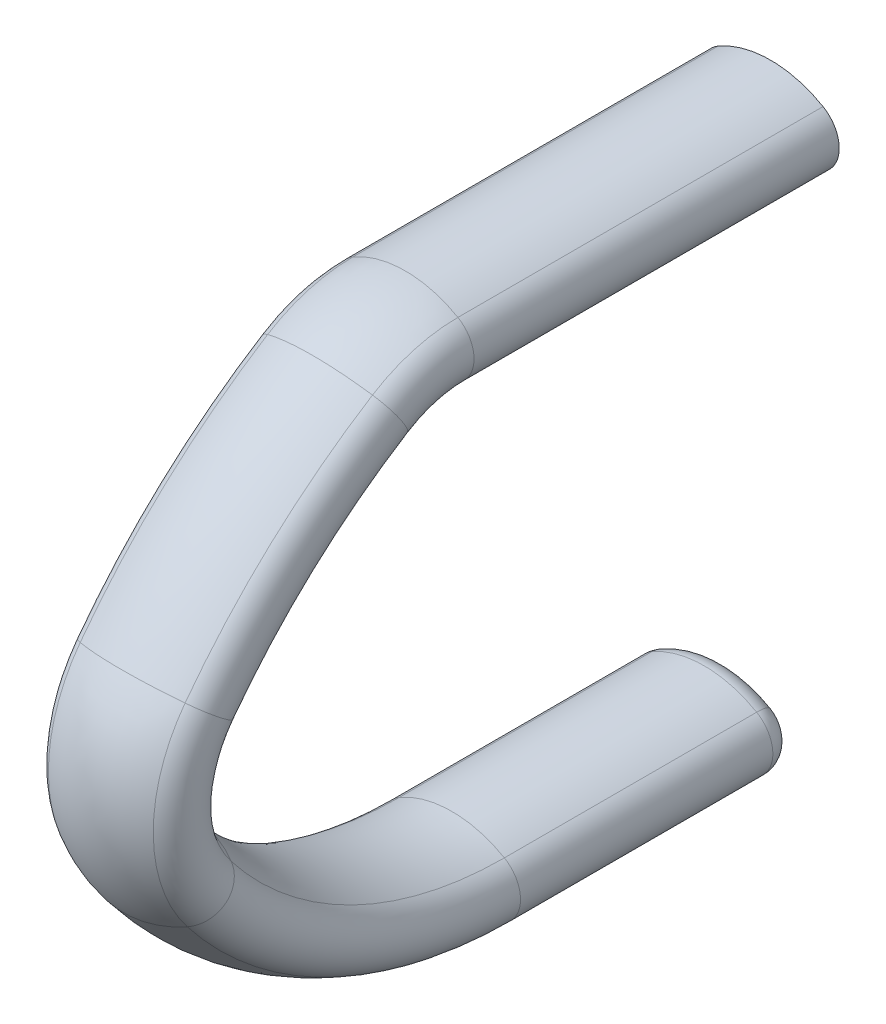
SolidWorks part; units mm, degrees
ref_plane "Plan de face" through (0, 0, 0) normal (0, 0, 1) x (1, 0, 0)
ref_plane "Plan de dessus" through (0, 0, 0) normal (0, 1, 0) x (1, 0, 0)
ref_plane "Plan de droite" through (0, 0, 0) normal (1, 0, 0) x (0, 0, -1)
sketch "Esquisse1" plane through (0, 0, 0) normal (1, 0, 0) x (0, 0, -1)
  line L0 (-20, -222) -> (-144, -222)
  line L1 (-165, 0) -> (0, 0)
  line L2 (0, 55) -> (0, -55) construction
  arc A0 (-277.3188, -156.8908) -> (-144, -222) centre (-144, -52.9524) ccw
  arc A1 (-278.1248, -84.1669) -> (-277.3188, -156.8908) centre (-230, -120) ccw
  arc A2 (-196.8748, -9.1669) -> (-278.1248, -84.1669) centre (-37.501, -263.3323) ccw
  arc A3 (-165, 0) -> (-196.8748, -9.1669) centre (-165, -60) ccw
  dimension "D1" = 60
  dimension "D2" = 60
  dimension "D3" = 124
  dimension "D5" = 300
  dimension "D4" = 222
  dimension "D7" = 165
  dimension "D9" = 65
  dimension "D10" = 120
  dimension "D11" = 20
sketch "Esquisse2" plane through (0, 0, 0) normal (0, 0, 1) x (1, 0, 0)
  line L1 (-31, 19) -> (31, 19) construction
  line L2 (-31, 19) -> (-31, -19) construction
  line L3 (-31, -19) -> (31, -19) construction
  line L4 (31, 19) -> (31, -19) construction
  line L5 (0, -55) -> (0, 55) construction
  line L6 (55, 0) -> (-55, 0) construction
  line L7 (0, -84.1669) -> (0, -9.1669) construction
  line L8 (-23.6962, 12.6506) -> (-12.6987, 19) construction
  arc A0 (-23.6962, 12.6506) -> (-23.6962, -12.6506) centre (-16.3923, 0) ccw
  arc A1 (23.6962, 12.6506) -> (23.6962, -12.6506) centre (16.3923, 0) cw
  arc A2 (-23.6962, -12.6506) -> (23.6962, -12.6506) centre (0, 28.3923) ccw
  arc A3 (-23.6962, 12.6506) -> (23.6962, 12.6506) centre (0, -28.3923) cw
  point P4 (0, 19)
  point P5 (-31, 0)
  dimension "D1" = 62
  dimension "D2" = 38
  dimension "D3" = 30
sweep "Balayage1" add profiles "Esquisse2" path "Esquisse1"
fillet "Congé1" radius 10 4 edges at (31, -222, 20) (0, -203, 20) (-31, -222, 20) (0, -241, 20)
shell "Coque1" thickness 5.5
ref_plane "Plan1" through (0, -241, 0) normal (0, 1, 0) x (-1, 0, 0)
sketch "Esquisse3" plane through (0, -241, 0) normal (0, 1, 0) x (-1, 0, 0)
  line L0 (0, 55) -> (0, -55) construction
  line L1 (15, 143) -> (-15, 143)
  line L2 (15, 143) -> (15, 33)
  line L3 (15, 33) -> (-15, 33)
  line L4 (-15, 143) -> (-15, 33)
  line L5 (-18.6962, 20) -> (18.6962, 20) construction
  point P4 (0, 33)
  dimension "D1" = 30
  dimension "D2" = 13
  dimension "D3" = 110
extrude "Extrusion1" cut sketch "Esquisse3" along normal blind 4.6
sketch "Esquisse4" plane through (0, -236.4, 0) normal (0, -1, 0) x (1, 0, 0)
  line L0 (0, 143) -> (0, 33) construction
  line L1 (-15, 143) -> (15, 143) construction
  line L2 (15, 33) -> (-15, 33) construction
  circle A0 centre (0, 128) radius 3
  circle A1 centre (0, 48) radius 3
  dimension "D1" = 6
  dimension "D2" = 15
  dimension "D3" = 15
extrude "Enlèv. mat.-Extru.1" cut sketch "Esquisse4" against normal blind 10
